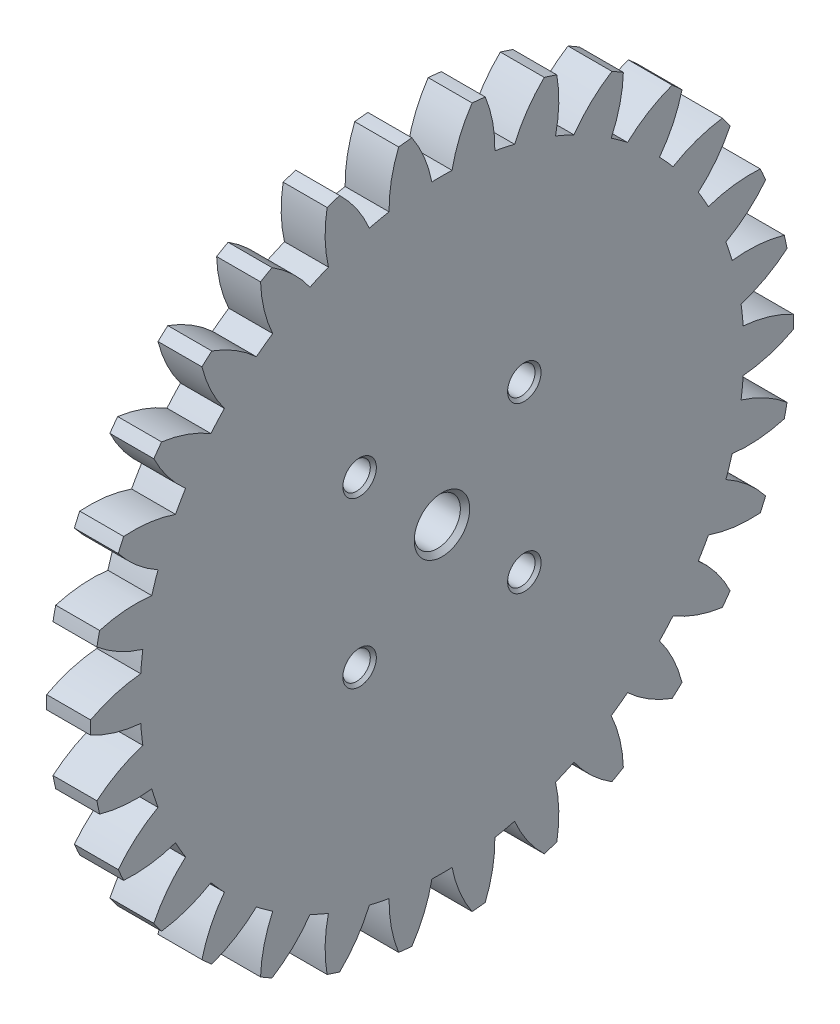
SolidWorks part; units mm, degrees
ref_plane "Plane1" through (0, 0, 0) normal (0, 0, 1) x (1, 0, 0)
ref_plane "Plane2" through (0, 0, 0) normal (0, 1, 0) x (1, 0, 0)
ref_plane "Plane3" through (0, 0, 0) normal (1, 0, 0) x (0, 0, -1)
other "Configuration Table"
sketch "HoldingSke" plane through (0, 0, 0) normal (0, 1, 0) x (1, 0, 0)
  line L0 (0, 0) -> (0.433, -0.25)
  line L1 (-15, 0) -> (100, 0) construction
  line L2 (0, 0) -> (-2.1039, 2.3779)
  line L3 (0, 0) -> (-11.863, 4.5341)
  line L4 (0, 0) -> (7.479, 4.318)
  line L5 (0, 0) -> (-46.8476, -17.4728)
  line L6 (0, 0) -> (-3.3159, -2.2372)
  line L7 (-2.1039, 2.3779) -> (8.6586, 51.2059)
  line L8 (-76.2, 54.61) -> (-75.9, 54.61)
  line L9 (-71.009, 38.7566) -> (-53.1078, 45.2721)
  line L10 (-76.2, 71.12) -> (104.1128, 71.12)
  line L11 (0, 0) -> (-4, 0)
  line L12 (-76.2, 101.6) -> (-76.133, 101.6)
  line L13 (24.9733, 27.94) -> (52.9518, 28.4284)
  line L14 (24.9733, 27.94) -> (24.9743, 27.94)
  line L15 (24.9733, 27.94) -> (100.4006, 29.5858)
  line L16 (-63.627, -2) -> (-12.827, -2)
  circle A0 centre (0, 0) radius 1
  circle A1 centre (0, 0) radius 27.499
  circle A2 centre (0, 0) radius 37.5
  circle A3 centre (0, 0) radius 1
sketch "BasProSke" plane through (0, 0, 0) normal (0, 1, 0) x (1, 0, 0)
  line L0 (-10, 0) -> (60, 0) construction
  line L1 (0, 0) -> (0, 32)
  line L2 (0, 0) -> (4, 0)
  line L3 (4, 0) -> (4, 32)
  line L4 (4, 32) -> (0, 32)
revolve "Base-Revolve" add sketch "BasProSke" angle 360 about L0
sketch "TooCutSke" plane through (0, 0, 0) normal (1, 0, 0) x (0, 0, -1)
  line L1 (0, 0) -> (0, 107) construction
  line L2 (0, 0) -> (-1.6873, 29.9525) construction
  line L3 (0, 0) -> (-6.2643, 59.6013) construction
  line L4 (-1.6873, 29.9525) -> (-3.1322, 29.8007) construction
  arc A0 (0.9186, 27.4837) -> (-0.9186, 27.4837) centre (0, 0) ccw
  arc A1 (2.7618, 31.9061) -> (-2.7618, 31.9061) centre (0, 0) ccw
  circle A2 centre (0, 0) radius 30 construction
  circle A3 centre (0, 0) radius 28.1908 construction
  arc A4 (-0.9186, 27.4837) -> (-2.7618, 31.9061) centre (-12.6936, 25.1712) ccw
  arc A5 (2.7618, 31.9061) -> (0.9186, 27.4837) centre (12.6936, 25.1712) ccw
extrude "ToothCut" cut sketch "TooCutSke" along normal through all
fillet "Breaks" [suppressed] radius 0.04
fillet "RootFillets" [suppressed] radius 0.501
pattern_circular "TeethCuts" count 30 every 12 about axis through (-10, 0, 0) along (1, 0, 0) of "ToothCut", "RootFillets", "Breaks"
sketch "HubNeaOneSke" plane through (0, 0, 0) normal (-1, 0, 0) x (0, 0, 1)
  circle A0 centre (0, 0) radius 27.499
extrude "HubNearOne" [suppressed] add sketch "HubNeaOneSke" along normal blind 46.0001
sketch "HubNeaBotSke" plane through (0, 0, 0) normal (-1, 0, 0) x (0, 0, 1)
  circle A0 centre (0, 0) radius 27.499
extrude "HubNearBoth" [suppressed] add sketch "HubNeaBotSke" along normal blind 23
ref_plane "FarPln" through (4, 0, 0) normal (1, 0, 0) x (0, 0, -1)
sketch "HubFarSke" plane through (4, 0, 0) normal (1, 0, 0) x (0, 0, -1)
  circle A0 centre (0, 0) radius 27.499
extrude "HubFar" [suppressed] add sketch "HubFarSke" along normal blind 23
sketch "BorSke" plane through (0, 0, 0) normal (1, 0, 0) x (0, 0, -1)
  circle A0 centre (0, 0) radius 1
extrude "Bore" cut sketch "BorSke" along normal mid plane 100.0001
sketch "KeySke" plane through (0, 0, 0) normal (1, 0, 0) x (0, 0, -1)
  line L0 (-0.4, 0) -> (-0.4, 1.3)
  line L1 (-0.4, 1.3) -> (0.4, 1.3)
  line L2 (0.4, 1.3) -> (0.4, 0)
  line L3 (0, 0) -> (0, 34) construction
  line L4 (-0.4, 0) -> (0.4, 0)
extrude "Keyway" [suppressed] cut sketch "KeySke" along normal mid plane 100.0001
pattern_circular "Keyway2" [suppressed] count 2 every 90 about axis through (-10, 0, 0) along (1, 0, 0)
sketch "草图2" plane through (4, 0, 0) normal (1, 0, 0) x (0, 0, -1)
  line L0 (0, 23.1342) -> (0, -16.8222) construction
  line L1 (-16.8222, 0) -> (21.397, 0) construction
  point P5 (-7.5, 7.5)
  point P6 (-7.5, -7.5)
  point P8 (7.5, -7.5)
  point P9 (7.5, 7.5)
  dimension "D1" = 15
  dimension "D2" = 15
hole_wizard "M3 螺纹孔1" positions "草图2" profile "草图3" tap size "M3" standard "GB"
sketch "草图3" plane through (4, 7.5, -7.5) normal (0, 1, 0) x (0, 0, -1)
  line L0 (0, 0) -> (0, 8.2511)
  line L1 (0, 8.2511) -> (1.25, 7.5)
  line L2 (1.25, 7.5) -> (1.25, 0.275)
  line L3 (1.25, 0.275) -> (1.525, 0)
  line L5 (1.525, 0) -> (0, 0)
  line L6 (-1.25, 0.275) -> (-1.525, 0) construction
  line L10 (0, 8.2511) -> (-1.25, 7.5) construction
  line L11 (0, -6.35) -> (0, 107.95) construction
  dimension "螺纹孔钻头直径" = 2.5
  dimension "螺纹孔钻头深度" = 7.5
  dimension "近端锥形沉头孔直径" = 3.05
  dimension "近端锥形沉头孔角度" = 90
  dimension "导头角度" = 118
sketch "草图6" plane through (4, 0, 0) normal (1, 0, 0) x (0, 0, -1)
  point P0 (0, 0)
hole_wizard "M5 螺纹孔1" positions "草图6" profile "草图5" tap size "M5" standard "GB"
sketch "草图5" plane through (4, 0, 0) normal (0, 1, 0) x (0, 0, -1)
  line L0 (0, 0) -> (0, 13.6618)
  line L1 (0, 13.6618) -> (2.1, 12.4)
  line L2 (2.1, 12.4) -> (2.1, 0.425)
  line L3 (2.1, 0.425) -> (2.525, 0)
  line L5 (2.525, 0) -> (0, 0)
  line L6 (-2.1, 0.425) -> (-2.525, 0) construction
  line L10 (0, 13.6618) -> (-2.1, 12.4) construction
  line L11 (0, -6.35) -> (0, 107.95) construction
  dimension "螺纹孔钻头直径" = 4.2
  dimension "螺纹孔钻头深度" = 12.4
  dimension "近端锥形沉头孔直径" = 5.05
  dimension "近端锥形沉头孔角度" = 90
  dimension "导头角度" = 118
equation "' \"Module@HoldingSke\" = 6.35"
equation "' \"Num_teeth@HoldingSke\" = 12"
equation "' \"Ap@HoldingSke\" =  20"
equation "' \"Ap@HoldingSke\" = 20"
equation "' \"Width@HoldingSke\" = 0.5 * 25.4"
equation "' \"Hub_dia@HoldingSke\"= 1 * 25.4"
equation "' \"Hub_dia@HoldingSke\" = 1 * 25.4"
equation "' \"Overall_len@HoldingSke\" = 1.0 * 25.4"
equation "' \"Bore@HoldingSke\" = 0.75 * 25.4"
equation "' \"T_dim@HoldingSke\" = 0.1 * 25.4"
equation "' \"Width@KeySke\" = 0.25 * 25.4"
equation "' \"Show_teeth@HoldingSke\" = 13"
equation "' \"Backlash@HoldingSke\" = 0.009 * 25.4"
equation "' \"Addendum_fac@HoldingSke\" = 1.0"
equation "' \"Dedendum_fac@HoldingSke\" = 1.25"
equation "' \"Dedendum_add@HoldingSke\" = 0.00005 * 25.4"
equation "' \"Clearance_fac@HoldingSke\" = 0.25"
equation "\"Pitch@HoldingSke\" = 1 / \"Module@HoldingSke\""
equation "\"Overcut_dia@TooCutSke\" = (\"Num_teeth@HoldingSke\" + 2 * \"Addendum_fac@HoldingSke\") / \"Pitch@HoldingSke\" + 0.002 * 25.4"
equation "\"Pitch_dia@TooCutSke\" = \"Num_teeth@HoldingSke\" / \"Pitch@HoldingSke\""
equation "\"Base_dia@TooCutSke\" = \"Num_teeth@HoldingSke\" / \"Pitch@HoldingSke\" * cos((\"Ap@HoldingSke\"  * 3.14159265 / 180))"
equation "\"Root_dia@TooCutSke\" = (\"Num_teeth@HoldingSke\" + 2) / \"Pitch@HoldingSke\" - 2 * (\"Addendum_fac@HoldingSke\" + \"Dedendum_fac@HoldingSke\") / \"Pitch@HoldingSke\" - \"Dedendum_add@HoldingSke\" * 2"
equation "\"Half_ang@TooCutSke\" = 180 / \"Num_teeth@HoldingSke\""
equation "\"Half_CT@TooCutSke\" = \"Num_teeth@HoldingSke\" / \"Pitch@HoldingSke\" * sin((3.14159265 / 2 / \"Num_teeth@HoldingSke\")) / 2 - 7 * \"Backlash@HoldingSke\" / 4"
equation "\"Flank_rad@TooCutSke\" = \"Num_teeth@HoldingSke\" / \"Pitch@HoldingSke\" / 5"
equation "\"Radius@RootFillets\" = \"Clearance_fac@HoldingSke\" / \"Pitch@HoldingSke\" + \"Dedendum_add@HoldingSke\""
equation "\"Break_rad@Breaks\" = 0.02 / \"Pitch@HoldingSke\""
equation "\"Thickness@HoldingSke\" = \"Width@HoldingSke\""
equation "\"OAL@HoldingSke\" = \"Thickness@HoldingSke\""
equation "\"MHD@HoldingSke\" = (\"Num_teeth@HoldingSke\" + 2) / \"Pitch@HoldingSke\" - 2 * (\"Addendum_fac@HoldingSke\" + \"Dedendum_fac@HoldingSke\")  / \"Pitch@HoldingSke\" - \"Dedendum_add@HoldingSke\" * 2"
equation "\"MBD@HoldingSke\" = (\"Num_teeth@HoldingSke\" + 2) / \"Pitch@HoldingSke\" - 2 * (\"Addendum_fac@HoldingSke\" + \"Dedendum_fac@HoldingSke\")  / \"Pitch@HoldingSke\" - \"Dedendum_add@HoldingSke\" * 2 - 0.002 * 25.4"
equation "\"MHD@HoldingSke\" = ((sgn( \"MHD@HoldingSke\" - \"Hub_dia@HoldingSke\" )-1)*( \"MHD@HoldingSke\" - \"Hub_dia@HoldingSke\" ))/-2+ \"Hub_dia@HoldingSke\""
equation "\"MBD@HoldingSke\" = ((sgn( \"MBD@HoldingSke\" - \"Bore@HoldingSke\" )-1)*( \"MBD@HoldingSke\" - \"Bore@HoldingSke\" ))/-2+ \"Bore@HoldingSke\""
equation "\"OAL@HoldingSke\" = ((sgn( \"OAL@HoldingSke\" - \"Overall_len@HoldingSke\" )+1)*( \"OAL@HoldingSke\" - \"Overall_len@HoldingSke\" ))/2 + \"Overall_len@HoldingSke\" + 0.000002 * 25.4"
equation "\"Num_teeth@TeethCuts\" = int( \"Show_teeth@HoldingSke\" ) + 1"
equation "\"Num_teeth@TeethCuts\" = ((sgn( \"Num_teeth@TeethCuts\" - \"Num_teeth@HoldingSke\" )-1)*( \"Num_teeth@TeethCuts\" - \"Num_teeth@HoldingSke\" ))/-2+ \"Num_teeth@HoldingSke\""
equation "\"Num_teeth@TeethCuts\" = ((sgn( \"Num_teeth@TeethCuts\" - 2.0)+1)*( \"Num_teeth@TeethCuts\" - 2.0))/2 +2.0"
equation "\"Angle@TeethCuts\" = 360.0 / \"Num_teeth@HoldingSke\""
equation "\"Diameter@BasProSke\" = (\"Num_teeth@HoldingSke\" + 2 * \"Addendum_fac@HoldingSke\") / \"Pitch@HoldingSke\""
equation "\"Thickness@BasProSke\"  = \"Thickness@HoldingSke\""
equation "' \"Fillet_rad@BasProSke\" =  \"Thickness@HoldingSke\" * 0.05"
equation "' \"Fillet_rad@BasProSke\" = \"Thickness@HoldingSke\" * 0.05"
equation "\"MHD@HoldingSke\" = ((sgn( \"MHD@HoldingSke\" - \"Root_dia@TooCutSke\" )-1)*( \"MHD@HoldingSke\" - \"Root_dia@TooCutSke\" ))/-2+ \"Root_dia@TooCutSke\""
equation "\"Diameter@HubNeaOneSke\" = \"MHD@HoldingSke\""
equation "\"Length@HubNearOne\" = \"OAL@HoldingSke\" - \"Thickness@BasProSke\""
equation "\"Diameter@HubNeaBotSke\" = \"MHD@HoldingSke\""
equation "\"Length@HubNearBoth\" = ( \"OAL@HoldingSke\" - \"Thickness@BasProSke\" ) / 2.0"
equation "\"Thickness@FarPln\" = \"Thickness@BasProSke\""
equation "\"Diameter@HubFarSke\" = \"MHD@HoldingSke\""
equation "\"Length@HubFar\" = ( \"OAL@HoldingSke\" - \"Thickness@BasProSke\" ) / 2.0"
equation "\"Diameter@BorSke\" = \"MBD@HoldingSke\""
equation "\"D1@Bore\" = \"OAL@HoldingSke\" * 2.0"
equation "\"D1@Keyway\" = \"OAL@HoldingSke\" * 2.0"
equation "\"Offset@KeySke\" = \"T_dim@HoldingSke\" + \"MBD@HoldingSke\" / 2.0"
